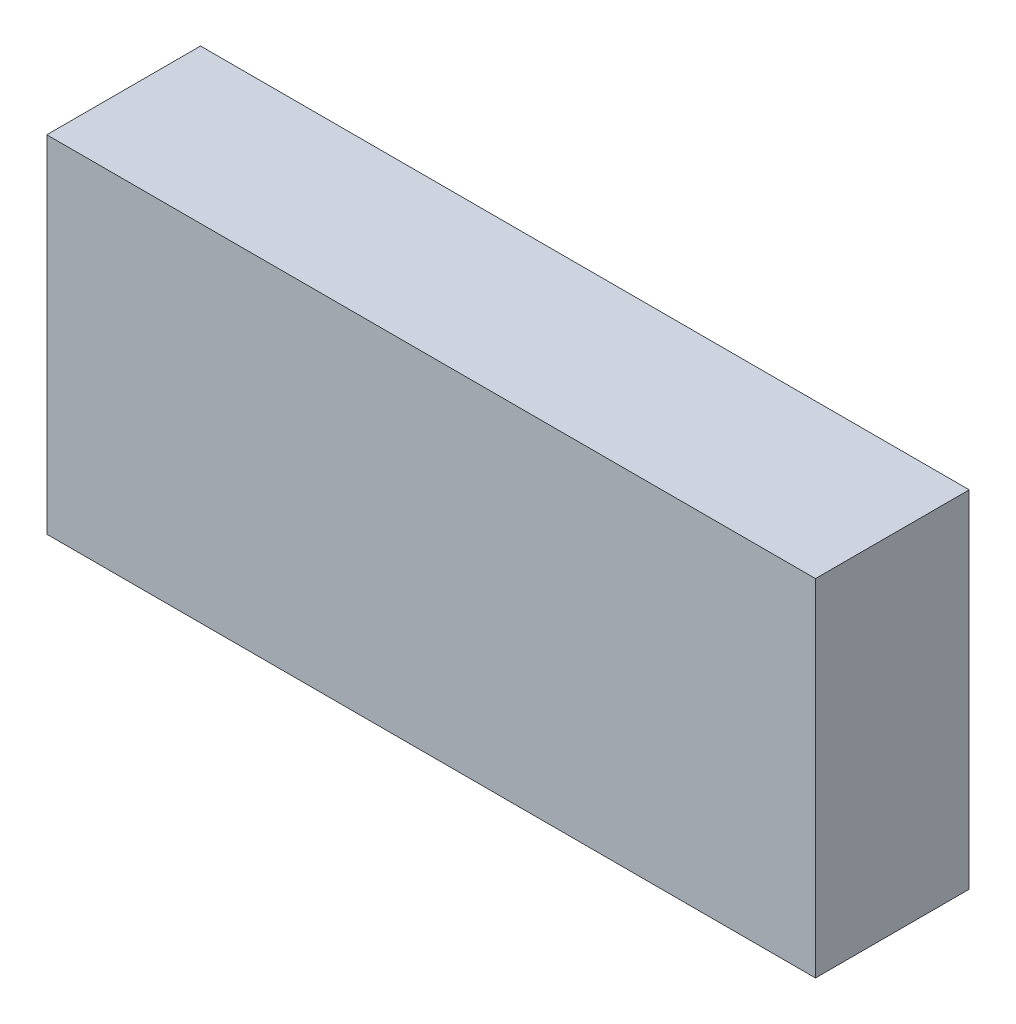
SolidWorks part; units mm, degrees
ref_plane "Plan de face" through (0, 0, 0) normal (0, 0, 1) x (1, 0, 0)
ref_plane "Plan de dessus" through (0, 0, 0) normal (0, 1, 0) x (1, 0, 0)
ref_plane "Plan de droite" through (0, 0, 0) normal (1, 0, 0) x (0, 0, -1)
sketch "Esquisse1" plane through (0, 0, 0) normal (0, 0, 1) x (1, 0, 0)
  line L1 (0, 0) -> (40, 0)
  line L2 (0, 0) -> (0, 18)
  line L3 (0, 18) -> (40, 18)
  line L4 (40, 0) -> (40, 18)
  dimension "D1" = 40
  dimension "D2" = 18
extrude "Extrusion1" add sketch "Esquisse1" along normal blind 8
